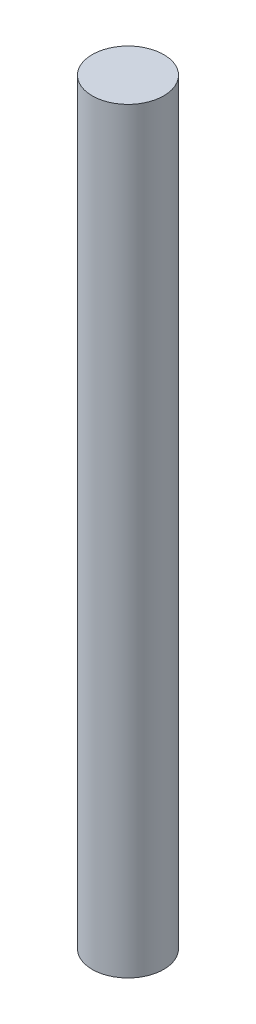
SolidWorks part; units mm, degrees
ref_plane "Plan de face" through (0, 0, 0) normal (0, 0, 1) x (1, 0, 0)
ref_plane "Plan de dessus" through (0, 0, 0) normal (0, 1, 0) x (1, 0, 0)
ref_plane "Plan de droite" through (0, 0, 0) normal (1, 0, 0) x (0, 0, -1)
sketch "Esquisse1" plane through (0, 0, 0) normal (0, 1, 0) x (1, 0, 0)
  circle A0 centre (0, 0) radius 3.45
  dimension "D1" = 6.9
extrude "Boss.-Extru.1" add sketch "Esquisse1" along normal blind 73
